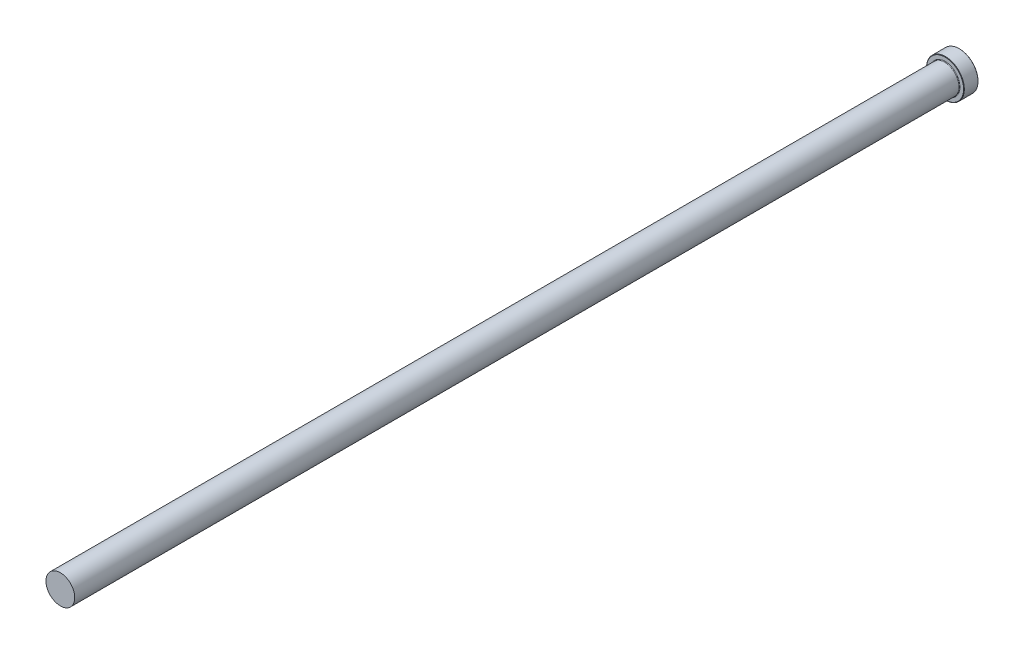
SolidWorks part; units mm, degrees
ref_plane "Front Plane" through (0, 0, 0) normal (0, 0, 1) x (1, 0, 0)
ref_plane "Top Plane" through (0, 0, 0) normal (0, 1, 0) x (1, 0, 0)
ref_plane "Right Plane" through (0, 0, 0) normal (1, 0, 0) x (0, 0, -1)
sketch "Sketch1" plane through (0, 0, 0) normal (1, 0, 0) x (0, 0, -1)
  line L0 (0, 0) -> (0, 10.5)
  line L1 (0, 10.45) -> (0, -10.45) construction
  line L2 (0, 10.5) -> (-8, 10.5)
  line L3 (-8, 10.5) -> (-8, 8.3)
  line L4 (-8.3, 8) -> (-500, 8)
  line L5 (-500, 8) -> (-500, 0)
  line L6 (10.45, 0) -> (-10.45, 0) construction
  line L7 (-500, 0) -> (0, 0)
  line L8 (-109.0506, 0) -> (16.9928, 0) construction
  arc A0 (-8, 8.3) -> (-8.3, 8) centre (-8.3, 8.3) cw
  dimension "D1" = 0.3
  dimension "D2" = 21
  dimension "D3" = 16
  dimension "D4" = 500
  dimension "D5" = 8
revolve "Revolve1" add sketch "Sketch1" angle 360 about L8
chamfer "Chamfer1" distance 0.2 angle 45 2 edges at (10.5, 0, 0) (10.5, 0, 8)
